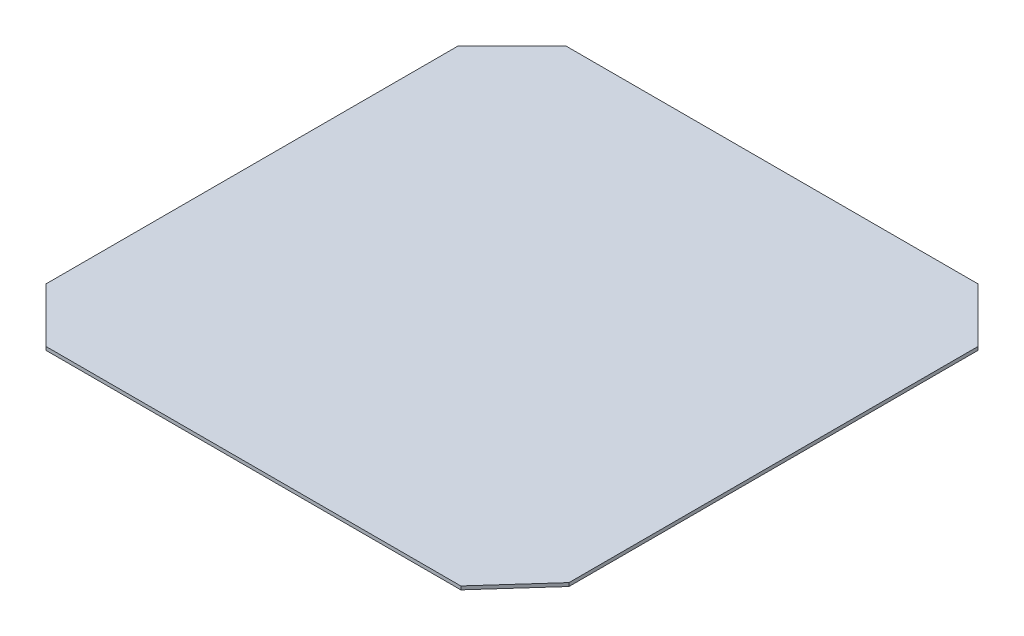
SolidWorks part; units mm, degrees
ref_plane "Front Plane" through (0, 0, 0) normal (0, 0, 1) x (1, 0, 0)
ref_plane "Top Plane" through (0, 0, 0) normal (0, 1, 0) x (1, 0, 0)
ref_plane "Right Plane" through (0, 0, 0) normal (1, 0, 0) x (0, 0, -1)
sketch "Sketch2" plane through (0, 0, 0) normal (0, 1, 0) x (1, 0, 0)
  line L0 (304.8, -237.9945) -> (304.8, 241.3)
  line L1 (304.8, 241.3) -> (241.3, 304.8)
  line L2 (241.3, 304.8) -> (-241.3, 304.8)
  line L3 (-241.3, 304.8) -> (-304.8, 241.3)
  line L4 (-304.8, 241.3) -> (-304.8, -241.3)
  line L5 (-304.8, -241.3) -> (-241.3, -304.8)
  line L6 (-241.3, -304.8) -> (244.7873, -304.8)
  line L7 (244.7873, -304.8) -> (304.8, -237.9945)
  point P7 (0, 304.8)
  point P10 (-304.8, 0)
  dimension "D1" = 609.6
  dimension "D2" = 609.6
  dimension "D3" = 63.5
  dimension "D4" = 63.5
extrude "Boss-Extrude1" add sketch "Sketch2" along normal blind 4
